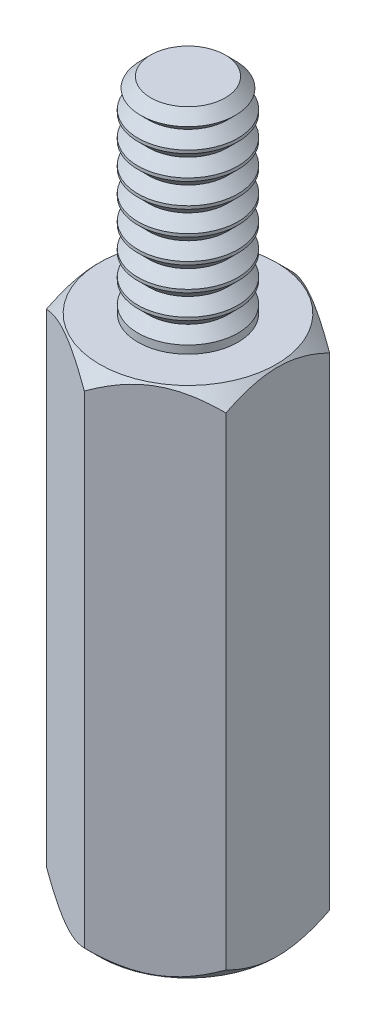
SolidWorks part; units mm, degrees
ref_plane "Plan de face" through (0, 0, 0) normal (0, 0, 1) x (1, 0, 0)
ref_plane "Plan de dessus" through (0, 0, 0) normal (0, 1, 0) x (1, 0, 0)
ref_plane "Plan de droite" through (0, 0, 0) normal (1, 0, 0) x (0, 0, -1)
sketch "Esquisse1" plane through (0, 0, 0) normal (0, 1, 0) x (1, 0, 0)
  line L0 (0, 0) -> (0, 4.0415) construction
  line L1 (0, 4.0415) -> (-3.5, 2.0207)
  line L2 (-3.5, 2.0207) -> (-3.5, -2.0207)
  line L3 (-3.5, -2.0207) -> (0, -4.0415)
  line L4 (0, -4.0415) -> (3.5, -2.0207)
  line L5 (3.5, -2.0207) -> (3.5, 2.0207)
  line L6 (3.5, 2.0207) -> (0, 4.0415)
  circle A0 centre (0, 0) radius 3.5 construction
  dimension "D1" = 7
extrude "Boss.-Extru.1" add sketch "Esquisse1" along normal blind 20
sketch "Esquisse2" plane through (0, 0, 0) normal (1, 0, 0) x (0, 0, -1)
  line L0 (-4.0415, 19.4) -> (-3.4415, 20)
  line L1 (-4.0415, 20) -> (-4.0415, 0) construction
  line L2 (-4.0415, 20) -> (-2.0207, 20) construction
  line L3 (-3.4415, 20) -> (-4.0415, 20)
  line L4 (-4.0415, 20) -> (-4.0415, 19.4)
  line L5 (0, 20) -> (0, 0) construction
  line L6 (-2.0207, 20) -> (2.0207, 20) construction
  line L7 (-4.0415, 10) -> (4.0415, 10) construction
  line L8 (4.0415, 20) -> (4.0415, 0) construction
  line L9 (-4.0415, 0) -> (-4.0415, 0.6)
  line L10 (-3.4415, 0) -> (-4.0415, 0)
  line L11 (-4.0415, 0.6) -> (-3.4415, 0)
  dimension "D1" = 0.6
  dimension "D2" = 0.6
revolve "Enlèvement de matière-Révolution1" cut sketch "Esquisse2" angle 360 about L5
sketch "Esquisse3" plane through (0, 20, 0) normal (0, 1, 0) x (1, 0, 0)
  circle A0 centre (0, 0) radius 1.95
  dimension "D1" = 3.9
extrude "Boss.-Extru.2" add sketch "Esquisse3" along normal blind 8
chamfer "Chanfrein1" distance 0.5 angle 45 1 edges at (0, 28, 1.95)
sketch "Esquisse4" plane through (0, 0, 0) normal (1, 0, 0) x (0, 0, -1)
  line L0 (-1.95, 20.31) -> (-1.5399, 20.7201)
  line L1 (-1.5399, 20.7201) -> (-1.95, 21.1302)
  line L2 (-1.95, 27.5) -> (-1.95, 20) construction
  line L3 (-1.95, 27.5) -> (-1.95, 20) construction
  line L4 (-1.95, 27.5) -> (-1.95, 20) construction
  line L5 (-1.95, 27.5) -> (-1.95, 20) construction
  line L6 (-1.95, 21.1302) -> (-1.95, 20.31)
  line L7 (-1.95, 21.25) -> (-1.5399, 21.6601)
  line L8 (-1.5399, 21.6601) -> (-1.95, 22.0702)
  line L9 (-1.95, 22.0702) -> (-1.95, 21.25)
  line L10 (-1.95, 22.19) -> (-1.5399, 22.6001)
  line L11 (-1.5399, 22.6001) -> (-1.95, 23.0102)
  line L12 (-1.95, 23.0102) -> (-1.95, 22.19)
  line L13 (-1.95, 23.13) -> (-1.5399, 23.5401)
  line L14 (-1.5399, 23.5401) -> (-1.95, 23.9502)
  line L15 (-1.95, 23.9502) -> (-1.95, 23.13)
  line L16 (-1.95, 24.07) -> (-1.5399, 24.4801)
  line L17 (-1.5399, 24.4801) -> (-1.95, 24.8902)
  line L18 (-1.95, 24.8902) -> (-1.95, 24.07)
  line L19 (-1.95, 25.01) -> (-1.5399, 25.4201)
  line L20 (-1.5399, 25.4201) -> (-1.95, 25.8302)
  line L21 (-1.95, 25.8302) -> (-1.95, 25.01)
  line L22 (-1.95, 25.95) -> (-1.5399, 26.3601)
  line L23 (-1.5399, 26.3601) -> (-1.95, 26.7702)
  line L24 (-1.95, 26.7702) -> (-1.95, 25.95)
  line L25 (-1.95, 26.89) -> (-1.5399, 27.3001)
  line L26 (-1.5399, 27.3001) -> (-1.95, 27.7102)
  line L27 (-1.95, 27.7102) -> (-1.95, 26.89)
  line L28 (-1.95, 27.83) -> (-1.5399, 28.2401)
  line L29 (-1.5399, 28.2401) -> (-1.95, 28.6502)
  line L30 (-1.95, 28.6502) -> (-1.95, 27.83)
  line L31 (-1.95, 28.77) -> (-1.5399, 29.1801)
  line L32 (-1.5399, 29.1801) -> (-1.95, 29.5902)
  line L33 (-1.95, 29.5902) -> (-1.95, 28.77)
  line L34 (-1.95, 29.71) -> (-1.5399, 30.1201)
  line L35 (-1.5399, 30.1201) -> (-1.95, 30.5302)
  line L36 (-1.95, 30.5302) -> (-1.95, 29.71)
  line L37 (-1.95, 30.65) -> (-1.5399, 31.0601)
  line L38 (-1.5399, 31.0601) -> (-1.95, 31.4702)
  line L39 (-1.95, 31.4702) -> (-1.95, 30.65)
  line L40 (-1.95, 31.59) -> (-1.5399, 32.0001)
  line L41 (-1.5399, 32.0001) -> (-1.95, 32.4102)
  line L42 (-1.95, 32.4102) -> (-1.95, 31.59)
  line L43 (-1.95, 32.53) -> (-1.5399, 32.9401)
  line L44 (-1.5399, 32.9401) -> (-1.95, 33.3502)
  line L45 (-1.95, 33.3502) -> (-1.95, 32.53)
  line L46 (-1.95, 33.47) -> (-1.5399, 33.8801)
  line L47 (-1.5399, 33.8801) -> (-1.95, 34.2902)
  line L48 (-1.95, 34.2902) -> (-1.95, 33.47)
  line L49 (0, 20) -> (0, 28) construction
  line L50 (3.4415, 20) -> (-3.4415, 20) construction
  line L51 (1.45, 28) -> (-1.45, 28) construction
  dimension "D1" = 0.58
  dimension "D2" = 0.58
  dimension "D3" = 0.31
  dimension "D5" = 0.94
  dimension "D4" = 15
revolve "Enlèvement de matière-Révolution2" cut sketch "Esquisse4" angle 360 about L49
sketch "Esquisse5" plane through (0, 0, 0) normal (0, -1, 0) x (-1, 0, 0)
  circle A0 centre (0, 0) radius 1.95
  circle A1 centre (0, 0) radius 3.4415 construction
  dimension "D1" = 3.9
extrude "Enlèv. mat.-Extru.1" cut sketch "Esquisse5" against normal blind 19
